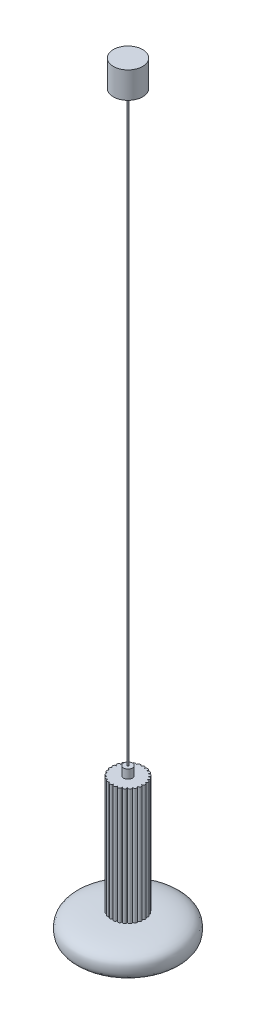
SolidWorks part; units mm, degrees
ref_plane "Alzado" through (0, 0, 0) normal (0, 0, 1) x (1, 0, 0)
ref_plane "Planta" through (0, 0, 0) normal (0, 1, 0) x (1, 0, 0)
ref_plane "Vista lateral" through (0, 0, 0) normal (1, 0, 0) x (0, 0, -1)
sketch "Croquis1" plane through (0, 0, 0) normal (0, 1, 0) x (1, 0, 0)
  circle A0 centre (0, 0) radius 25
  dimension "D1" = 50
extrude "Saliente-Extruir1" add sketch "Croquis1" along normal blind 200
sketch "Croquis2" plane through (0, 0, 0) normal (0, 0, 1) x (1, 0, 0)
  line L0 (0, 0) -> (0, -50) construction
  line L1 (0, -25) -> (90, -25) construction
  line L2 (-40.1136, -50) -> (40.1136, -50) construction
  line L5 (90, -36.3311) -> (90, -13.3752) construction
  line L6 (0, 0) -> (0, -50)
  spline S0 degree 3 poles (0, 0) (82.4419, 3.0957) (90.249, -14.2274) (89.8512, -37.8214) (82.5, -50) (0, -50) knots 0 0 0 0 0.418503 0.518503 1 1 1 1
  dimension "D3" = 275
  dimension "D4" = 275
  dimension "D1" = 50
  dimension "D2" = 90
revolve "Revolución1" add sketch "Croquis2" angle 360 about L6
sketch "Croquis3" plane through (0, 200, 0) normal (0, 1, 0) x (1, 0, 0)
  circle A0 centre (0, 0) radius 7.5
  dimension "D1" = 15
extrude "Saliente-Extruir2" add sketch "Croquis3" along normal blind 15 separate body
sketch "Croquis4" plane through (0, 215, 0) normal (0, 1, 0) x (1, 0, 0)
  circle A0 centre (0, 0) radius 1.5
  dimension "D1" = 3
extrude "Saliente-Extruir3" add sketch "Croquis4" along normal blind 1000 separate body
ref_plane "Plano1" through (0, -70, 0) normal (0, 1, 0) x (1, 0, 0)
sketch "Croquis5" plane through (0, -70, 0) normal (0, 1, 0) x (1, 0, 0)
  circle A0 centre (0, 0) radius 25
  dimension "D1" = 50
extrude "Cortar-Extruir1" cut sketch "Croquis5" along normal blind 40
fillet "Redondeo1" radius 20 1 edges at (-25, -49.6314, 0)
sketch "Croquis6" plane through (0, -30, 0) normal (0, -1, 0) x (1, 0, 0)
  circle A0 centre (0, 0) radius 25
extrude "Saliente-Extruir4" add sketch "Croquis6" along normal blind 1 separate body
sketch "Croquis7" plane through (0, 200, 0) normal (0, 1, 0) x (1, 0, 0)
  line L0 (0, 0) -> (0, 25) construction
  circle A0 centre (0, 0) radius 25 construction
  circle A1 centre (0, 25) radius 3
  circle A2 centre (6.2172, 24.2146) radius 3
  circle A3 centre (12.0438, 21.9077) radius 3
  circle A4 centre (17.1137, 18.2242) radius 3
  circle A5 centre (21.1082, 13.3957) radius 3
  circle A6 centre (23.7764, 7.7254) radius 3
  circle A7 centre (24.9507, 1.5698) radius 3
  circle A8 centre (24.5572, -4.6845) radius 3
  circle A9 centre (22.6207, -10.6445) radius 3
  circle A10 centre (19.2628, -15.9356) radius 3
  circle A11 centre (14.6946, -20.2254) radius 3
  circle A12 centre (9.2031, -23.2444) radius 3
  circle A13 centre (3.1333, -24.8029) radius 3
  circle A14 centre (-3.1333, -24.8029) radius 3
  circle A15 centre (-9.2031, -23.2444) radius 3
  circle A16 centre (-14.6946, -20.2254) radius 3
  circle A17 centre (-19.2628, -15.9356) radius 3
  circle A18 centre (-22.6207, -10.6445) radius 3
  circle A19 centre (-24.5572, -4.6845) radius 3
  circle A20 centre (-24.9507, 1.5698) radius 3
  circle A21 centre (-23.7764, 7.7254) radius 3
  circle A22 centre (-21.1082, 13.3957) radius 3
  circle A23 centre (-17.1137, 18.2242) radius 3
  circle A24 centre (-12.0438, 21.9077) radius 3
  circle A25 centre (-6.2172, 24.2146) radius 3
  point P124 (0, 0)
  dimension "D1" = 6
  dimension "D2" = 25
extrude "Saliente-Extruir5" add sketch "Croquis7" against normal blind 199
sketch "Croquis8" plane through (0, 1215, 0) normal (0, 1, 0) x (1, 0, 0)
  circle A0 centre (0, 0) radius 25
  dimension "D1" = 50
extrude "Saliente-Extruir6" add sketch "Croquis8" along normal blind 45 separate body
